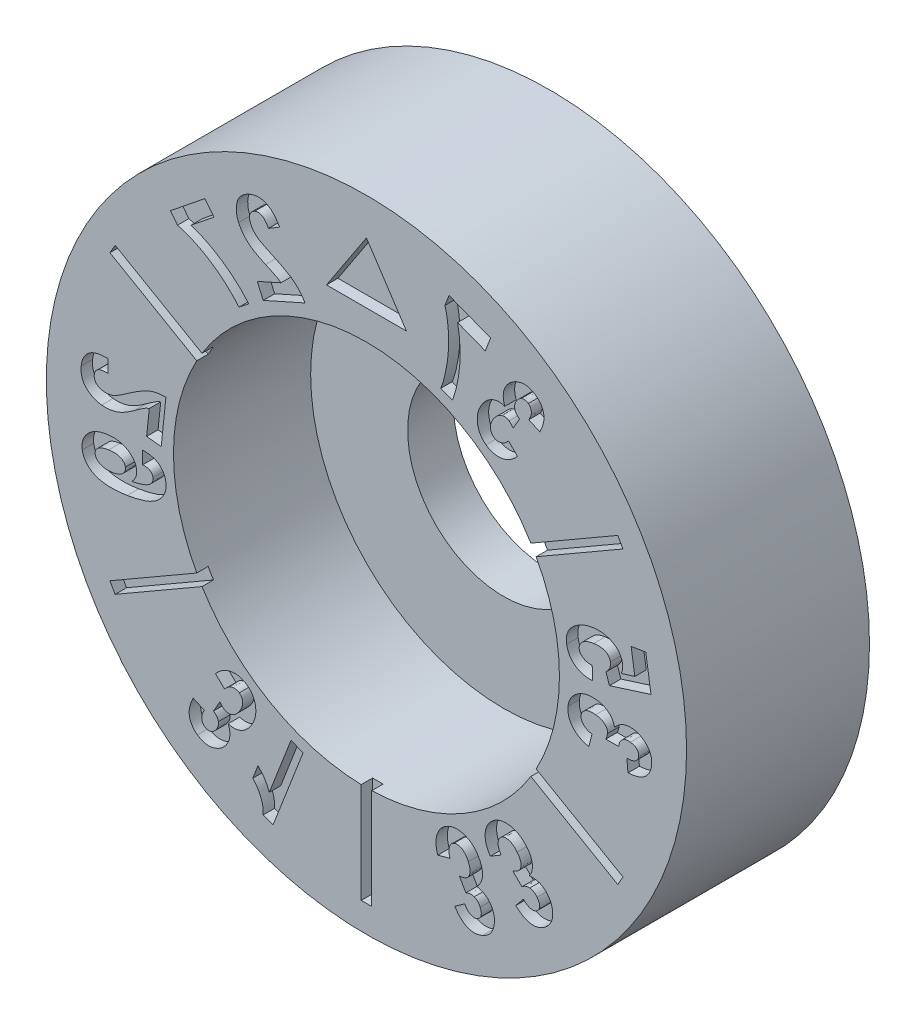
SolidWorks part; units mm, degrees
ref_plane "Front Plane" through (0, 0, 0) normal (0, 0, 1) x (1, 0, 0)
ref_plane "Top Plane" through (0, 0, 0) normal (0, 1, 0) x (1, 0, 0)
ref_plane "Right Plane" through (0, 0, 0) normal (1, 0, 0) x (0, 0, -1)
sketch "Sketch4" plane through (0, 0, 0) normal (0, 0, 1) x (1, 0, 0)
  circle A0 centre (0, 0) radius 7
  dimension "D1" = 14
extrude "Boss-Extrude2" add sketch "Sketch4" against normal blind 4
sketch "Sketch5" plane through (0, 0, 0) normal (0, 0, 1) x (1, 0, 0)
  circle A0 centre (0, 0) radius 4.22
  dimension "D1" = 8.44
extrude "Cut-Extrude2" cut sketch "Sketch5" against normal blind 3
sketch "Sketch6" plane through (0, 0, -3) normal (0, 0, 1) x (1, 0, 0)
  circle A0 centre (0, 0) radius 2.1
  dimension "D1" = 4.2
extrude "Cut-Extrude3" cut sketch "Sketch6" against normal through all
sketch "Sketch1" plane through (0, 0, 0) normal (0, 0, 1) x (1, 0, 0)
  line L6 (0.8741, 4.8653) -> (0, 6.192)
  line L7 (0, 6.192) -> (-0.8741, 4.8653)
  line L8 (-0.8741, 4.8653) -> (0.8741, 4.8653)
sketch "Sketch2" plane through (0, 0, 0) normal (0, 0, 1) x (1, 0, 0)
  line L0 (0, 0) -> (0, -7.6937) construction
  line L1 (0, 0) -> (-3.8469, -6.663) construction
  line L2 (-0.115, -3.1) -> (0.115, -3.1)
  line L3 (-0.115, -3.1) -> (-0.115, -6.4114)
  line L4 (-0.115, -6.4114) -> (0.115, -6.4114)
  line L6 (0.115, -3.1) -> (0.115, -6.4114)
  line L11 (0, 0) -> (-6.663, -3.8469) construction
  line L12 (-2.6272, -1.6496) -> (-5.4949, -3.3053)
  line L13 (-2.7422, -1.4504) -> (-2.6272, -1.6496)
  line L14 (-2.7422, -1.4504) -> (-5.6099, -3.1061)
  line L15 (-5.6099, -3.1061) -> (-5.4949, -3.3053)
  line L16 (0, 0) -> (-7.6937, 0) construction
  line L21 (0, 0) -> (-6.663, 3.8469) construction
  line L22 (-2.7422, 1.4504) -> (-5.6099, 3.1061)
  line L23 (-2.6272, 1.6496) -> (-2.7422, 1.4504)
  line L24 (-2.6272, 1.6496) -> (-5.4949, 3.3053)
  line L25 (-5.4949, 3.3053) -> (-5.6099, 3.1061)
  line L26 (0, 0) -> (-3.8469, 6.663) construction
  line L31 (0, 0) -> (0, 7.6937) construction
  line L36 (0, 0) -> (3.8469, 6.663) construction
  line L41 (0, 0) -> (6.663, 3.8469) construction
  line L42 (2.6272, 1.6496) -> (5.4949, 3.3053)
  line L43 (2.7422, 1.4504) -> (2.6272, 1.6496)
  line L44 (2.7422, 1.4504) -> (5.6099, 3.1061)
  line L45 (5.6099, 3.1061) -> (5.4949, 3.3053)
  line L46 (0, 0) -> (7.6937, 0) construction
  line L51 (0, 0) -> (6.663, -3.8469) construction
  line L52 (2.7422, -1.4504) -> (5.6099, -3.1061)
  line L53 (2.6272, -1.6496) -> (2.7422, -1.4504)
  line L54 (2.6272, -1.6496) -> (5.4949, -3.3053)
  line L55 (5.4949, -3.3053) -> (5.6099, -3.1061)
  line L56 (0, 0) -> (3.8469, -6.663) construction
  line L61 (0.115, 6.4114) -> (-0.115, 6.4114)
  line L62 (0.115, 3.1) -> (0.115, 6.4114)
  line L63 (-0.115, 3.1) -> (-0.115, 6.4114)
  line L64 (0.115, 3.1) -> (-0.115, 3.1)
  line L65 (1.6496, 2.6272) -> (3.3053, 5.4949)
  line L66 (3.3053, 5.4949) -> (3.1061, 5.6099)
  line L67 (1.4504, 2.7422) -> (3.1061, 5.6099)
  line L68 (1.6496, 2.6272) -> (1.4504, 2.7422)
  line L69 (-1.6496, 2.6272) -> (-3.3053, 5.4949)
  line L70 (-1.4504, 2.7422) -> (-3.1061, 5.6099)
  line L71 (-3.1061, 5.6099) -> (-3.3053, 5.4949)
  line L72 (-1.4504, 2.7422) -> (-1.6496, 2.6272)
  line L73 (-3.1, 0.115) -> (-6.4114, 0.115)
  line L74 (-3.1, -0.115) -> (-6.4114, -0.115)
  line L75 (3.1, 0.115) -> (6.4114, 0.115)
  line L76 (3.1, -0.115) -> (6.4114, -0.115)
  line L77 (6.4114, -0.115) -> (6.4114, 0.115)
  line L78 (3.1, -0.115) -> (3.1, 0.115)
  line L79 (-3.1, 0.115) -> (-3.1, -0.115)
  line L80 (-6.4114, 0.115) -> (-6.4114, -0.115)
  line L81 (-1.6496, -2.6272) -> (-3.3053, -5.4949)
  line L82 (-1.4504, -2.7422) -> (-3.1061, -5.6099)
  line L83 (-3.3053, -5.4949) -> (-3.1061, -5.6099)
  line L84 (-1.6496, -2.6272) -> (-1.4504, -2.7422)
  line L85 (1.6496, -2.6272) -> (3.3053, -5.4949)
  line L86 (1.4504, -2.7422) -> (3.1061, -5.6099)
  line L87 (1.4504, -2.7422) -> (1.6496, -2.6272)
  line L88 (3.1061, -5.6099) -> (3.3053, -5.4949)
  arc A0 (-1.2968, 4.3091) -> (0, 4.5) centre (0, 0) ccw construction
  text T0 "27    29    31    33    35    37" font "Arial Narrow" height 1.8
  point P67 (0, 0)
  dimension "D1" = 9
  dimension "D6" = 12
extrude "Cut-Extrude1" cut sketch "Sketch2" against normal blind 0.25
extrude "Cut-Extrude4" cut sketch "Sketch1" against normal blind 0.25
sketch "Sketch7" plane through (0, 0, 0) normal (0, 1, 0) x (1, 0, 0)
  line L0 (7, 4) -> (-7, 4) construction
  line L1 (-4.5, 4) -> (-5.5, 4)
  arc A0 (-5.5, 4) -> (-4.5, 4) centre (-5, 4) cw
  dimension "D2" = 0.5
  dimension "D1" = 5
revolve "Revolve1" add sketch "Sketch7" angle 360 about L1
